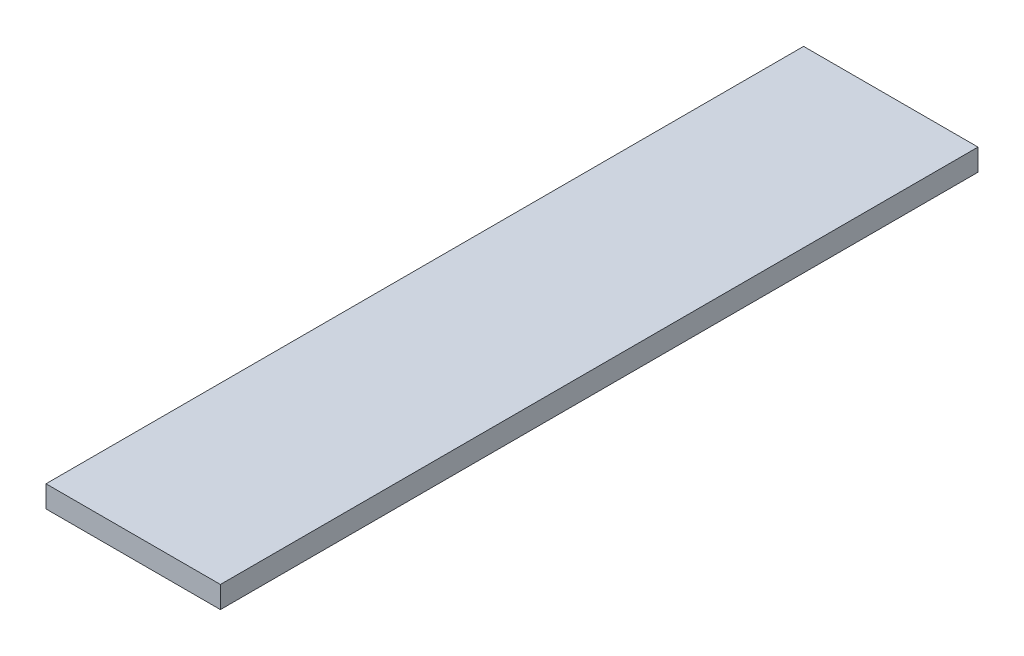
SolidWorks part; units mm, degrees
ref_plane "FRONT" through (0, 0, 0) normal (0, 0, 1) x (1, 0, 0)
ref_plane "TOP" through (0, 0, 0) normal (0, 1, 0) x (1, 0, 0)
ref_plane "RIGHT" through (0, 0, 0) normal (1, 0, 0) x (0, 0, -1)
sketch "Sketch1" plane through (0, 0, 0) normal (0, 1, 0) x (1, 0, 0)
  line L1 (-25.4, 110.3312) -> (25.4, 110.3312)
  line L2 (-25.4, 110.3312) -> (-25.4, -110.3312)
  line L3 (-25.4, -110.3312) -> (25.4, -110.3312)
  line L4 (25.4, 110.3312) -> (25.4, -110.3312)
  line L5 (-25.4, 110.3312) -> (25.4, -110.3312) construction
  line L6 (-25.4, -110.3312) -> (25.4, 110.3312) construction
  point P0 (0, 0)
  dimension "D1" = 50.8
  dimension "D2" = 220.6625
extrude "Boss-Extrude1" add sketch "Sketch1" along normal blind 6.35
